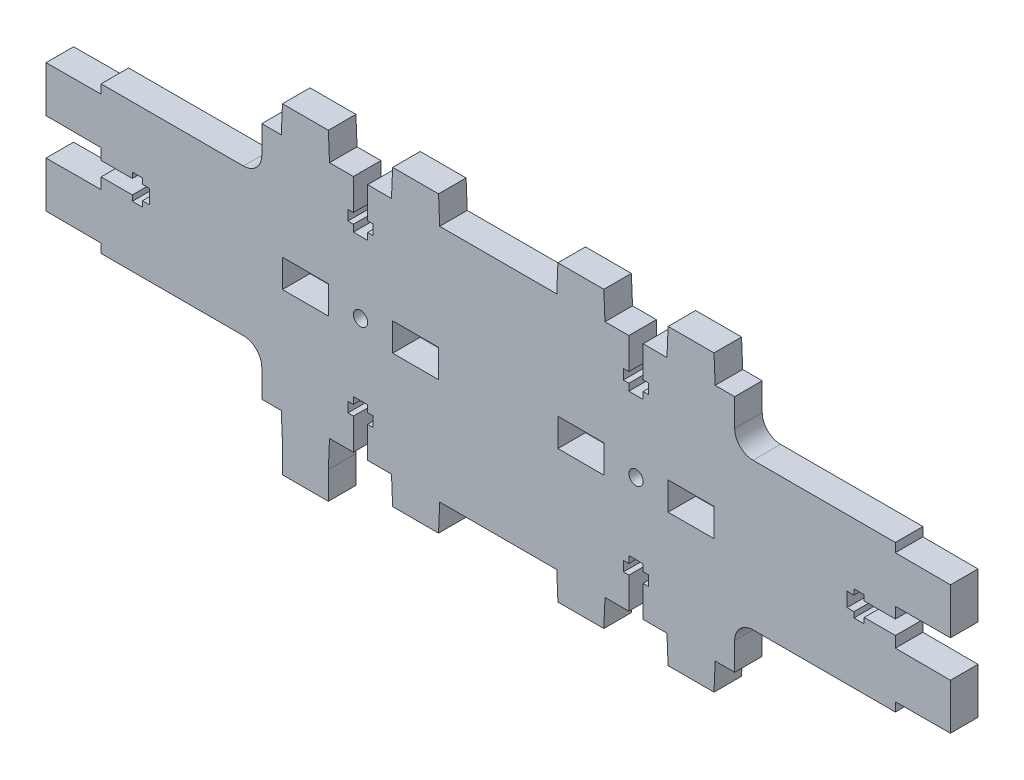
SolidWorks part; units mm, degrees
ref_plane "Спереди" through (0, 0, 0) normal (0, 0, 1) x (1, 0, 0)
ref_plane "Сверху" through (0, 0, 0) normal (0, 1, 0) x (1, 0, 0)
ref_plane "Справа" through (0, 0, 0) normal (1, 0, 0) x (0, 0, -1)
sketch "Эскиз1" plane through (0, 0, 0) normal (0, 0, 1) x (1, 0, 0)
  line L0 (0, 84.7298) -> (0, 0) construction
  line L1 (0, 0) -> (159.715, 0) construction
  line L2 (0, 0) -> (12.75, 0)
  line L3 (86.5, 10) -> (51.5, 10)
  line L4 (51.5, 52) -> (47.25, 52)
  line L5 (12.75, 0) -> (13, -6)
  line L6 (13, -6) -> (23, -6)
  line L7 (23, -6) -> (23.25, 0)
  line L8 (30, 0) -> (30, 18.5174) construction
  line L9 (23.25, 0) -> (28.45, 0)
  line L10 (47.25, 0) -> (47, -6)
  line L11 (47, -6) -> (37, -6)
  line L12 (37, -6) -> (36.75, 0)
  line L13 (18, -6) -> (18, 9.5634) construction
  line L14 (31.55, 0) -> (31.55, 6.8)
  line L15 (31.55, 6.8) -> (32.75, 6.8)
  line L16 (32.75, 6.8) -> (32.75, 9)
  line L17 (32.75, 9) -> (31.55, 9)
  line L18 (31.55, 9) -> (31.55, 10.5)
  line L19 (31.55, 10.5) -> (28.45, 10.5)
  line L20 (31.55, 0) -> (36.75, 0)
  line L21 (47.25, 0) -> (51.5, 0)
  line L22 (28.45, 9) -> (28.45, 10.5)
  line L23 (27.25, 9) -> (28.45, 9)
  line L24 (27.25, 6.8) -> (27.25, 9)
  line L25 (28.45, 6.8) -> (27.25, 6.8)
  line L26 (28.45, 0) -> (28.45, 6.8)
  line L27 (0, 0) -> (0, 52)
  line L28 (86.5, 29.95) -> (98.5, 30)
  line L29 (98.5, 30) -> (98.5, 40)
  line L30 (98.5, 40) -> (86.5, 40.05)
  line L31 (86.5, 40.05) -> (86.5, 42)
  line L32 (92.5, 26) -> (0, 26) construction
  line L33 (51.5, 42) -> (51.5, 52)
  line L34 (28.45, 52) -> (28.45, 45.2)
  line L35 (28.45, 45.2) -> (27.25, 45.2)
  line L36 (27.25, 45.2) -> (27.25, 43)
  line L37 (27.25, 43) -> (28.45, 43)
  line L38 (28.45, 43) -> (28.45, 41.5)
  line L39 (31.55, 41.5) -> (28.45, 41.5)
  line L40 (31.55, 43) -> (31.55, 41.5)
  line L41 (32.75, 43) -> (31.55, 43)
  line L42 (32.75, 45.2) -> (32.75, 43)
  line L43 (31.55, 45.2) -> (32.75, 45.2)
  line L44 (31.55, 52) -> (31.55, 45.2)
  line L45 (86.5, 42) -> (51.5, 42)
  line L46 (37, 58) -> (36.75, 52)
  line L47 (47, 58) -> (37, 58)
  line L48 (47.25, 52) -> (47, 58)
  line L49 (23, 58) -> (23.25, 52)
  line L50 (13, 58) -> (23, 58)
  line L51 (12.75, 52) -> (13, 58)
  line L52 (12.75, 52) -> (0, 52)
  line L53 (28.45, 52) -> (23.25, 52)
  line L54 (36.75, 52) -> (31.55, 52)
  line L55 (86.5, 29.95) -> (86.5, 27.55)
  line L56 (86.5, 27.55) -> (79.7, 27.55)
  line L57 (79.7, 27.55) -> (79.7, 28.75)
  line L58 (79.7, 28.75) -> (77.5, 28.75)
  line L59 (77.5, 28.75) -> (77.5, 27.55)
  line L60 (77.5, 27.55) -> (76, 27.55)
  line L61 (76, 27.55) -> (76, 24.45)
  line L62 (98.5, 35) -> (86.9588, 35) construction
  line L63 (98.5, 12) -> (86.5, 11.95)
  line L64 (77.5, 24.45) -> (76, 24.45)
  line L65 (77.5, 23.25) -> (77.5, 24.45)
  line L66 (51.5, 10) -> (51.5, 0)
  line L67 (79.7, 23.25) -> (77.5, 23.25)
  line L68 (79.7, 24.45) -> (79.7, 23.25)
  line L69 (86.5, 24.45) -> (79.7, 24.45)
  line L70 (86.5, 22.05) -> (86.5, 24.45)
  line L71 (98.5, 22) -> (98.5, 12)
  line L72 (86.5, 22.05) -> (98.5, 22)
  line L77 (86.5, 10) -> (86.5, 11.95)
  line L78 (23, 29.05) -> (13, 29.05)
  line L79 (37, 22.95) -> (47, 22.95)
  line L80 (37, 22.95) -> (37, 29.05)
  line L81 (37, 29.05) -> (47, 29.05)
  line L82 (47, 22.95) -> (47, 29.05)
  line L83 (37, 22.95) -> (47, 29.05) construction
  line L84 (37, 29.05) -> (47, 22.95) construction
  line L85 (23, 29.05) -> (13, 22.95) construction
  line L86 (23, 22.95) -> (13, 29.05) construction
  line L87 (13, 22.95) -> (13, 29.05)
  line L88 (23, 22.95) -> (23, 29.05)
  line L89 (23, 22.95) -> (13, 22.95)
  circle A0 centre (30, 26) radius 1.55
  point P73 (76, 26)
  point P83 (42, 26)
  dimension "D19" = 3.1
  dimension "D3" = 10
  dimension "D4" = 6
  dimension "D5" = 10.5
  dimension "D6" = 12
  dimension "D7" = 10.5
  dimension "D8" = 5.5
  dimension "D9" = 3.1
  dimension "D10" = 2.2
  dimension "D11" = 1.5
  dimension "D12" = 30
  dimension "D13" = 12
  dimension "D14" = 10
  dimension "D15" = 10.1
  dimension "D16" = 9
  dimension "D17" = 10
  dimension "D18" = 6.1
  dimension "D20" = 24
  dimension "D21" = 173
  dimension "D22" = 52
  dimension "D23" = 35
  dimension "D24" = 10
  dimension "D25" = 3.1
  dimension "D26" = 5.5
  dimension "D27" = 1.5
  dimension "D28" = 10.5
  dimension "D29" = 2.2
extrude "Бобышка-Вытянуть1" add sketch "Эскиз1" along normal blind 6
fillet "Скругление1" radius 4 2 edges at (51.5, 10, 3) (51.5, 42, 3)
mirror "Зеркальное отражение1" about plane through (0, 0, 6) normal (1, 0, 0)
sketch "Эскиз2" plane through (0, 0, 6) normal (0, 0, 1) x (1, 0, 0)
  line L1 (-47, -6) -> (-37, -6)
  line L2 (-47, -6) -> (-47, -12)
  line L3 (-47, -12) -> (-37, -12)
  line L4 (-37, -6) -> (-37, -12)
  dimension "D1" = 6
extrude "Бобышка-Вытянуть2" add sketch "Эскиз2" against normal up to surface (6 mm away)
